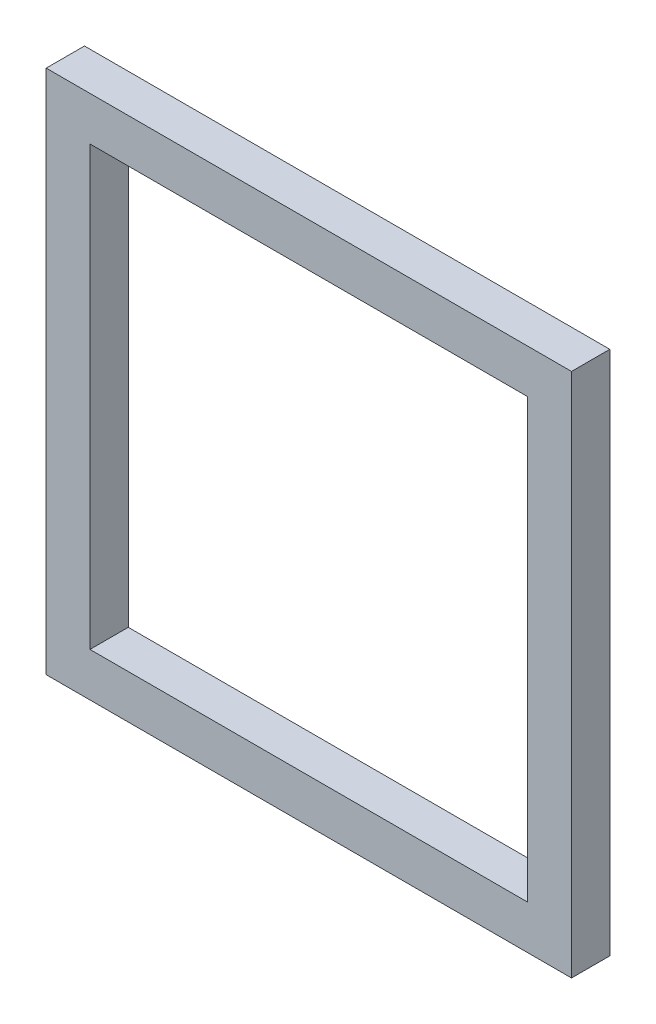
SolidWorks part; units mm, degrees
ref_plane "Vorne" through (0, 0, 0) normal (0, 0, 1) x (1, 0, 0)
ref_plane "Oben" through (0, 0, 0) normal (0, 1, 0) x (1, 0, 0)
ref_plane "Rechts" through (0, 0, 0) normal (1, 0, 0) x (0, 0, -1)
sketch "Skizze1" plane through (0, 0, 0) normal (0, 0, 1) x (1, 0, 0)
  line L0 (300, 1400) -> (700, 1400) construction
  line L1 (700, 1400) -> (700, 1000) construction
  line L2 (300, 1000) -> (700, 1000) construction
  line L3 (300, 1400) -> (300, 1000) construction
  line L4 (300, 1400) -> (700, 1400)
  line L5 (700, 1400) -> (700, 1000)
  line L6 (300, 1000) -> (700, 1000)
  line L7 (300, 1400) -> (300, 1000)
ref_plane "Ebene1" through (300, 1000, 0) normal (0, -1, 0) x (1, 0, 0)
sketch "Skizze2" plane through (300, 1000, 0) normal (0, -1, 0) x (1, 0, 0)
  line L1 (-40, 35) -> (0, 35)
  line L2 (-40, 35) -> (-40, 0)
  line L3 (-40, 0) -> (0, 0)
  line L4 (0, 35) -> (0, 0)
  dimension "D1" = 35
  dimension "D2" = 40
sweep "Austragung1" add profiles "Skizze2" path "Skizze1"
